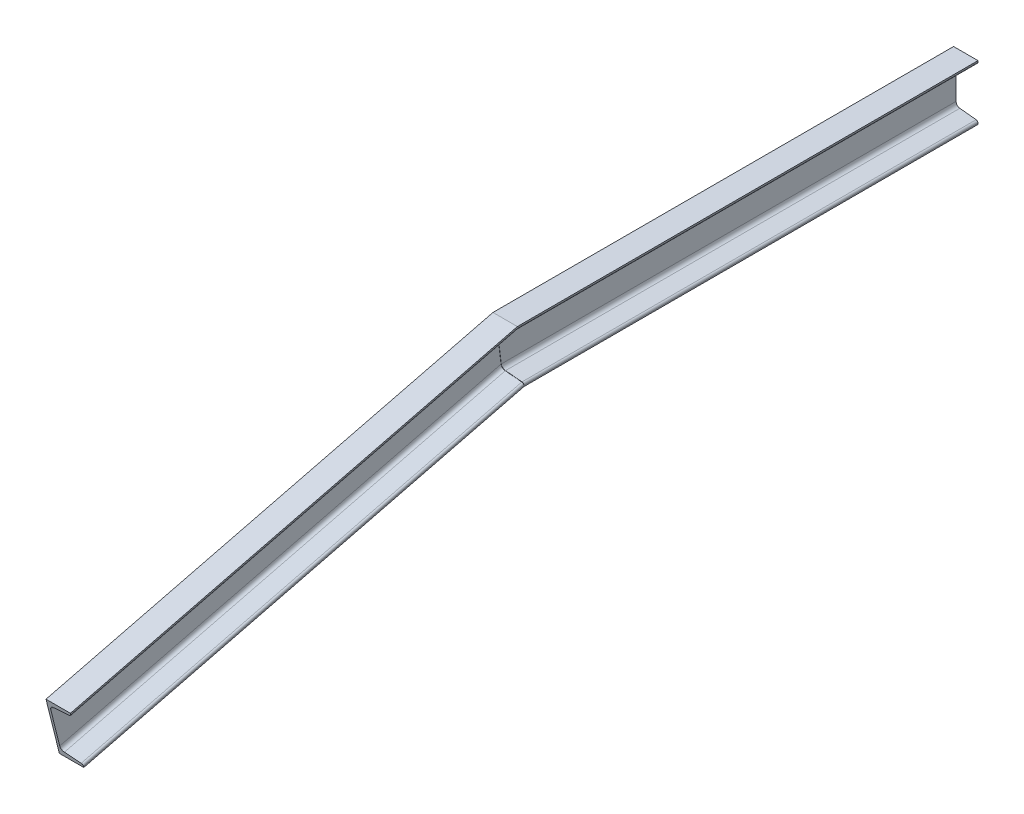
SolidWorks part; units mm, degrees
ref_plane "前视基准面" through (0, 0, 0) normal (0, 0, 1) x (1, 0, 0)
ref_plane "上视基准面" through (0, 0, 0) normal (0, 1, 0) x (1, 0, 0)
ref_plane "右视基准面" through (0, 0, 0) normal (1, 0, 0) x (0, 0, -1)
sketch "草图1" plane through (0, 0, 0) normal (0, 0, 1) x (1, 0, 0)
  line L0 (0, 60) -> (0, -60)
  line L1 (0, -60) -> (53, -60)
  line L2 (53, -60) -> (53, -57.5512)
  line L3 (48.9711, -53.0759) -> (13.5578, -49.3482)
  line L4 (5.5, -40.3976) -> (5.5, 40.3976)
  line L5 (13.5578, 49.3482) -> (48.9711, 53.0759)
  line L6 (53, 57.5512) -> (53, 60)
  line L7 (53, 60) -> (0, 60)
  line L8 (29.25, 60) -> (29.25, 51) construction
  line L9 (29.25, -51) -> (29.25, -60) construction
  arc A0 (5.5, 40.3976) -> (13.5578, 49.3482) centre (14.5, 40.3976) cw
  arc A1 (13.5578, -49.3482) -> (5.5, -40.3976) centre (14.5, -40.3976) cw
  arc A2 (48.9711, 53.0759) -> (53, 57.5512) centre (48.5, 57.5512) ccw
  arc A3 (53, -57.5512) -> (48.9711, -53.0759) centre (48.5, -57.5512) ccw
  point P19 (53, 53.5)
  point P22 (53, -53.5)
  dimension "D11" = 9
  dimension "D12" = 4.5
  dimension "D1" = 120
  dimension "D2" = 5.5
  dimension "D3" = 53
  dimension "D4" = 53
  dimension "D5" = 6.5
  dimension "D6" = 6.5
  dimension "D7" = 60
  dimension "D8" = 23.75
  dimension "D9" = 9
  dimension "D10" = 9
extrude "拉伸1" add sketch "草图1" along normal blind 1000
ref_plane "基准面1" through (0, -231.2242, 927.3896) normal (0, 0.2419, -0.9703) x (-1, 0, 0)
sketch "草图2" plane through (0, -231.2242, 927.3896) normal (0, 0.2419, -0.9703) x (-1, 0, 0)
  line L0 (0, 300.1396) -> (-53, 300.1396)
  line L1 (-53, 300.1396) -> (-53, 297.6908)
  line L2 (-48.9711, 293.2155) -> (-13.5578, 289.4878)
  line L3 (-5.5, 280.5373) -> (-5.5, 199.742)
  line L4 (-13.5578, 190.7914) -> (-48.9711, 187.0637)
  line L5 (-53, 297.7636) -> (-53, 55.8417) construction
  line L6 (-53, 182.5885) -> (-53, 180.1396)
  line L7 (-53, 180.1396) -> (0, 180.1396)
  line L8 (0, 180.1396) -> (0, 300.1396)
  line L9 (-29.25, 300.1396) -> (-29.25, 291.1396) construction
  line L10 (-29.25, 189.1396) -> (-29.25, 180.1396) construction
  arc A0 (-53, 297.6908) -> (-48.9711, 293.2155) centre (-48.5, 297.6908) ccw
  arc A1 (-48.9711, 187.0637) -> (-53, 182.5885) centre (-48.5, 182.5885) ccw
  arc A2 (-13.5578, 289.4878) -> (-5.5, 280.5373) centre (-14.5, 280.5373) cw
  arc A3 (-5.5, 199.742) -> (-13.5578, 190.7914) centre (-14.5, 199.742) cw
  point P20 (-53, 293.6396)
  point P23 (-53, 186.6396)
  dimension "D8" = 4.5
  dimension "D9" = 9
  dimension "D1" = 120
  dimension "D2" = 6.5
  dimension "D3" = 6.5
  dimension "D4" = 5.5
  dimension "D5" = 23.75
  dimension "D6" = 9
  dimension "D7" = 9
extrude "拉伸2" add sketch "草图2" against normal blind 1000
sketch "草图3" plane through (0, 0, 0) normal (-1, 0, 0) x (0, 0, 1)
  line L0 (1000, 60) -> (985.2659, -60) construction
  line L1 (998.7336, 51.3274) -> (981.9615, -85.2705)
  line L2 (981.9615, -85.2705) -> (982.3585, -85.3193)
  line L3 (982.3585, -85.3193) -> (999.1307, 51.2786)
  line L4 (999.1307, 51.2786) -> (998.7336, 51.3274)
  dimension "D1" = 0.4
extrude "切除-拉伸1" cut sketch "草图3" against normal blind 1000
sketch "草图4" plane through (0, -473.1461, 1897.6854) normal (0, -0.2419, 0.9703) x (1, 0, 0)
  line L0 (53, 297.6908) -> (53, 182.5885)
  line L8 (0, 300.1396) -> (0, 180.1396)
  line L9 (0, 180.1396) -> (53, 180.1396)
  line L10 (53, 180.1396) -> (53, 182.5885)
  line L11 (48.9711, 187.0637) -> (13.5578, 190.7914)
  line L12 (5.5, 199.742) -> (5.5, 280.5373)
  line L13 (13.5578, 289.4878) -> (48.9711, 293.2155)
  line L14 (53, 297.6908) -> (53, 300.1396)
  line L15 (53, 300.1396) -> (0, 300.1396)
  line L19 (48.9711, 187.0637) -> (13.5578, 190.7914)
  line L20 (5.5, 199.742) -> (5.5, 280.5373)
  line L21 (13.5578, 289.4878) -> (48.9711, 293.2155)
  arc A4 (53, 182.5885) -> (48.9711, 187.0637) centre (48.5, 182.5885) ccw
  arc A5 (5.5, 199.742) -> (13.5578, 190.7914) centre (14.5, 199.742) ccw
  arc A6 (13.5578, 289.4878) -> (5.5, 280.5373) centre (14.5, 280.5373) ccw
  arc A7 (48.9711, 293.2155) -> (53, 297.6908) centre (48.5, 297.6908) ccw
  arc A8 (53, 182.5885) -> (48.9711, 187.0637) centre (48.5, 182.5885) ccw
  arc A9 (5.5, 199.742) -> (13.5578, 190.7914) centre (14.5, 199.742) ccw
  arc A10 (13.5578, 289.4878) -> (5.5, 280.5373) centre (14.5, 280.5373) ccw
  arc A11 (48.9711, 293.2155) -> (53, 297.6908) centre (48.5, 297.6908) ccw
  dimension "D1" = 0
extrude "切除-拉伸2" cut sketch "草图4" against normal up to surface (985.365 mm away)
sketch "草图5" plane through (0, 0, 0) normal (0, 0, -1) x (-1, 0, 0)
  line L0 (-53, 57.5512) -> (-53, -57.5512)
  line L8 (0, 60) -> (-53, 60)
  line L9 (-53, 60) -> (-53, 57.5512)
  line L10 (-48.9711, 53.0759) -> (-13.5578, 49.3482)
  line L11 (-5.5, 40.3976) -> (-5.5, -40.3976)
  line L12 (-13.5578, -49.3482) -> (-48.9711, -53.0759)
  line L13 (-53, -57.5512) -> (-53, -60)
  line L14 (-53, -60) -> (0, -60)
  line L15 (0, -60) -> (0, 60)
  line L18 (-48.9711, 53.0759) -> (-13.5578, 49.3482)
  line L19 (-5.5, 40.3976) -> (-5.5, -40.3976)
  line L20 (-13.5578, -49.3482) -> (-48.9711, -53.0759)
  arc A4 (-53, 57.5512) -> (-48.9711, 53.0759) centre (-48.5, 57.5512) ccw
  arc A5 (-5.5, 40.3976) -> (-13.5578, 49.3482) centre (-14.5, 40.3976) ccw
  arc A6 (-13.5578, -49.3482) -> (-5.5, -40.3976) centre (-14.5, -40.3976) ccw
  arc A7 (-48.9711, -53.0759) -> (-53, -57.5512) centre (-48.5, -57.5512) ccw
  arc A8 (-53, 57.5512) -> (-48.9711, 53.0759) centre (-48.5, 57.5512) ccw
  arc A9 (-5.5, 40.3976) -> (-13.5578, 49.3482) centre (-14.5, 40.3976) ccw
  arc A10 (-13.5578, -49.3482) -> (-5.5, -40.3976) centre (-14.5, -40.3976) ccw
  arc A11 (-48.9711, -53.0759) -> (-53, -57.5512) centre (-48.5, -57.5512) ccw
  dimension "D1" = 0
extrude "切除-拉伸3" cut sketch "草图5" against normal up to surface (999.4978 mm away)
